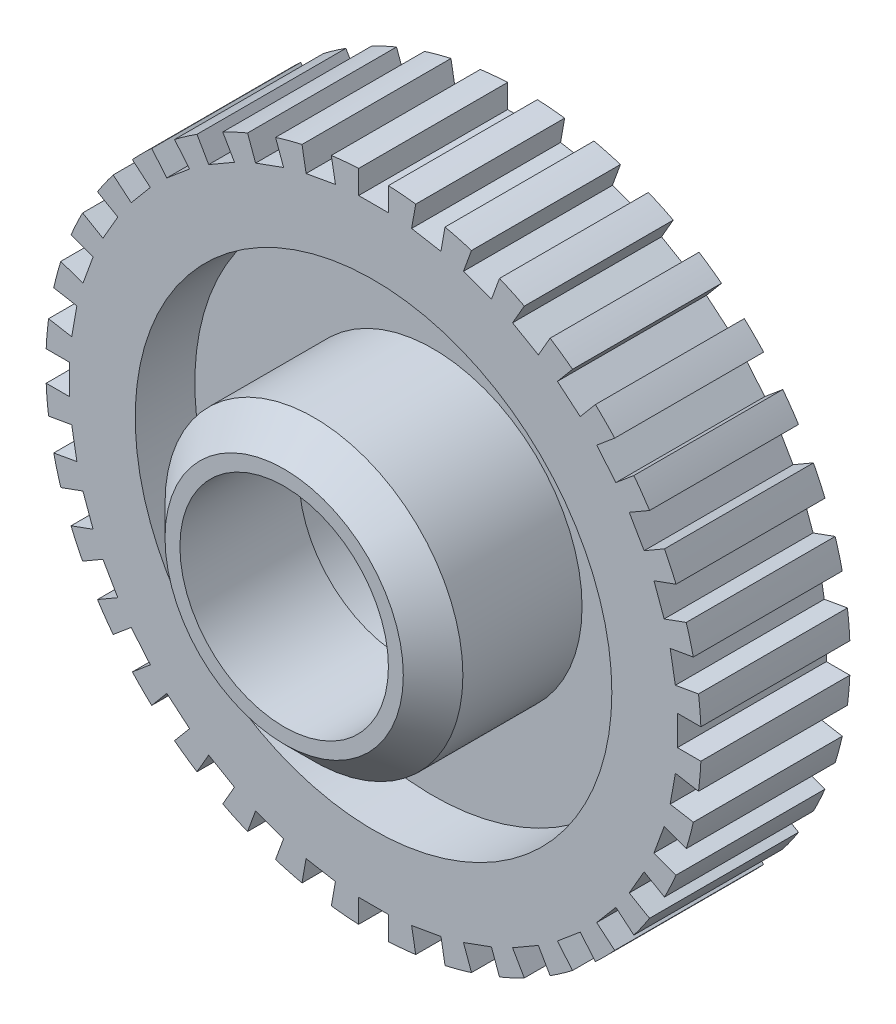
SolidWorks part; units mm, degrees
ref_plane "Plane1" through (0, 0, 0) normal (0, 0, 1) x (1, 0, 0)
ref_plane "Plane2" through (0, 0, 0) normal (0, 1, 0) x (1, 0, 0)
ref_plane "Plane3" through (0, 0, 0) normal (1, 0, 0) x (0, 0, -1)
sketch "Esquisse1" plane through (0, 0, 0) normal (0, 0, 1) x (1, 0, 0)
  circle A0 centre (0, 0) radius 11
  dimension "D1" = 22
extrude "Base-Extrusion" add sketch "Esquisse1" along normal blind 5
sketch "Esquisse2" plane through (0, 0, 5) normal (0, 0, 1) x (1, 0, 0)
  circle A0 centre (0, 0) radius 8
  dimension "D1" = 16
extrude "Enlèv. mat.-Extru.1" cut sketch "Esquisse2" against normal blind 2
sketch "Esquisse3" plane through (0, 0, 3) normal (0, 0, 1) x (1, 0, 0)
  circle A0 centre (0, 0) radius 5
  dimension "D1" = 10
extrude "Boss.-Extru.1" add sketch "Esquisse3" along normal blind 5
sketch "Esquisse4" plane through (0, 0, 0) normal (0, 0, -1) x (-1, 0, 0)
  circle A0 centre (0, 0) radius 8
  dimension "D1" = 16
extrude "Enlèv. mat.-Extru.2" cut sketch "Esquisse4" against normal blind 2
sketch "Esquisse5" plane through (0, 0, 2) normal (0, 0, -1) x (-1, 0, 0)
  circle A0 centre (0, 0) radius 5
  dimension "D1" = 10
extrude "Boss.-Extru.2" add sketch "Esquisse5" along normal blind 2
sketch "Esquisse6" plane through (0, 0, 0) normal (0, 0, -1) x (-1, 0, 0)
  circle A0 centre (0, 0) radius 3.5
  dimension "D1" = 7
extrude "Enlèv. mat.-Extru.3" cut sketch "Esquisse6" against normal blind 22
sketch "Esquisse8" plane through (0, 0, 0) normal (0, 0, -1) x (-1, 0, 0)
  circle A0 centre (0, 0) radius 4
  dimension "D1" = 8
extrude "Enlèv. mat.-Extru.5" cut sketch "Esquisse8" against normal blind 4
chamfer "Chanfrein1" distance 1 angle 45
sketch "Esquisse9" plane through (0, 0, 0) normal (0, 0, -1) x (-1, 0, 0)
  line L0 (0, 0) -> (0, 20) construction
  line L1 (-0.5, 11.6) -> (0.5, 11.6)
  line L2 (-0.5, 11.6) -> (-0.5, 10.2)
  line L3 (0.5, 10.2) -> (-0.5, 10.2)
  line L4 (0.5, 10.2) -> (0.5, 11.6)
  dimension "D1" = 1
  dimension "D2" = 0.5
extrude "Enlèv. mat.-Extru.6" cut sketch "Esquisse9" against normal blind 14
pattern_circular "Répétition circulaire1" count 36 every 10
sketch "Esquisse11" plane through (0, 0, 3) normal (0, 0, 1) x (1, 0, 0)
  circle A0 centre (0, 0) radius 9
